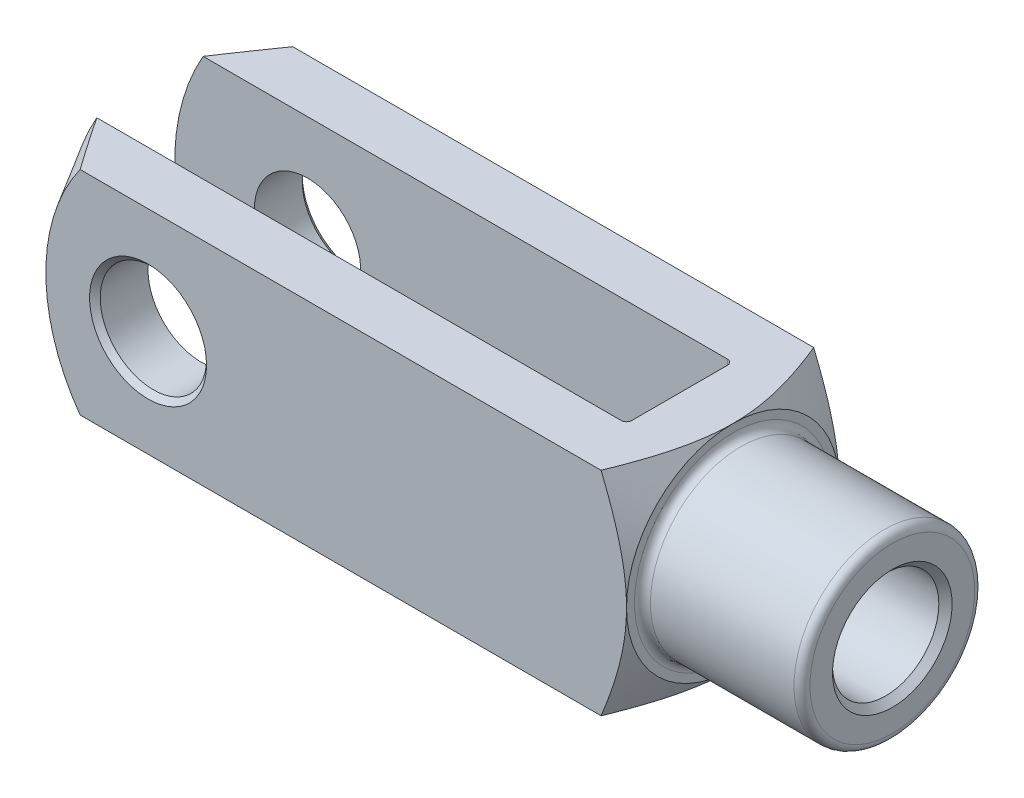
SolidWorks part; units mm, degrees
ref_plane "Front Plane" through (0, 0, 0) normal (0, 0, 1) x (1, 0, 0)
ref_plane "Top Plane" through (0, 0, 0) normal (0, 1, 0) x (1, 0, 0)
ref_plane "Right Plane" through (0, 0, 0) normal (1, 0, 0) x (0, 0, -1)
sketch "Sketch1" plane through (0, 0, 0) normal (1, 0, 0) x (0, 0, -1)
  line L0 (0, 0) -> (0, 50000) construction
  line L1 (0, 0) -> (50000, 0) construction
  line L2 (-20, -20) -> (-20, 20)
  line L3 (-20, 20) -> (20, 20)
  line L4 (20, -20) -> (20, 20)
  line L5 (-20, -20) -> (20, -20)
  point P9 (0, 20)
  point P11 (20, 0)
  point P12 (-20, 0)
  dimension "D1" = 40
  dimension "D2" = 40
extrude "Extrude1" add sketch "Sketch1" against normal blind 145
sketch "Sketch2" plane through (0, 0, 0) normal (1, 0, 0) x (0, 0, -1)
  circle A0 centre (0, 0) radius 17
  circle A1 centre (0, 0) radius 34
  dimension "D1" = 34
  dimension "D2" = 68
extrude "Extrude2" cut sketch "Sketch2" against normal blind 30
sketch "Sketch3" plane through (0, 0, 20) normal (0, 0, 1) x (1, 0, 0)
  circle A0 centre (-120, 0) radius 10
  dimension "D1" = 20
  dimension "D2" = 120
extrude "Extrude3" cut sketch "Sketch3" against normal through all
sketch "Sketch4" plane through (0, 20, 0) normal (0, 1, 0) x (1, 0, 0)
  line L0 (0, 0) -> (-50000, 0) construction
  line L1 (-145, -10) -> (-145, 10)
  line L2 (-145, 20) -> (-145, -20) construction
  line L3 (-145, 10) -> (-40, 10)
  line L4 (-40, 10) -> (-40, -10)
  line L5 (-120, 20) -> (-120, -20) construction
  line L6 (-145, -10) -> (-40, -10)
  point P7 (-120, 0)
  point P13 (-40, 0)
  point P14 (-145, 0)
  dimension "D1" = 80
  dimension "D2" = 20
extrude "Extrude4" cut sketch "Sketch4" against normal through all
fillet "Fillet1" radius 1 2 edges at (-40, 0, 10) (-40, 0, -10)
fillet "Fillet2" radius 1.5 2 edges at (0, 0, -17) (-30, 0, -17)
chamfer "Chamfer2" distance 1 angle 45 2 edges at (-110, 0, -20) (-110, 0, 20)
sketch "Sketch6" plane through (0, 0, 0) normal (0, 0, 1) x (1, 0, 0)
  line L0 (-30, -20) -> (-30, -40)
  line L1 (-30, -40) -> (-41.547, -40)
  line L2 (-41.547, -40) -> (-30, -20)
  dimension "D1" = 30
  dimension "D2" = 40
revolve "Cut-Revolve1" cut sketch "Sketch6" angle 360 about axis through (-30, 0, 0) along (1, 0, 0)
sketch "Sketch7" plane through (0, 0, 0) normal (0, 1, 0) x (1, 0, 0)
  line L0 (-139.2265, -20) -> (-145, -10)
  line L1 (-145, 10) -> (-139.2265, 20)
  line L2 (-139.2265, 20) -> (-185, 20)
  line L3 (-145, 10) -> (-145, -10)
  line L4 (-185, 20) -> (-185, -20)
  line L5 (-185, -20) -> (-139.2265, -20)
  line L6 (-145, 20) -> (-34.7829, 20) construction
  line L7 (-145, -20) -> (-34.7829, -20) construction
  line L8 (-105, 0.6162) -> (-105, 50000.6162) construction
  dimension "D1" = 120
  dimension "D2" = 40
  dimension "D3" = 40
revolve "Cut-Revolve2" cut sketch "Sketch7" angle 180 about L8
sketch "Sketch8" plane through (0, 0, 0) normal (1, 0, 0) x (0, 0, -1)
  circle A0 centre (0, 0) radius 10
  dimension "D1" = 20
extrude "Extrude5" cut sketch "Sketch8" against normal through all
chamfer "Chamfer3" distance 1.25 angle 45 1 edges at (0, 0, -10)
equation "\"D2@Sketch1\" = \"D1@Sketch1\""
equation "\"D2@Sketch2\" = \"D1@Sketch2\"*2"
equation "\"D2@Sketch6\" = \"D1@Sketch1\""
equation "\"D2@Sketch7\" = \"D1@Sketch1\""
equation "\"D3@Sketch7\" = \"D1@Sketch1\""
